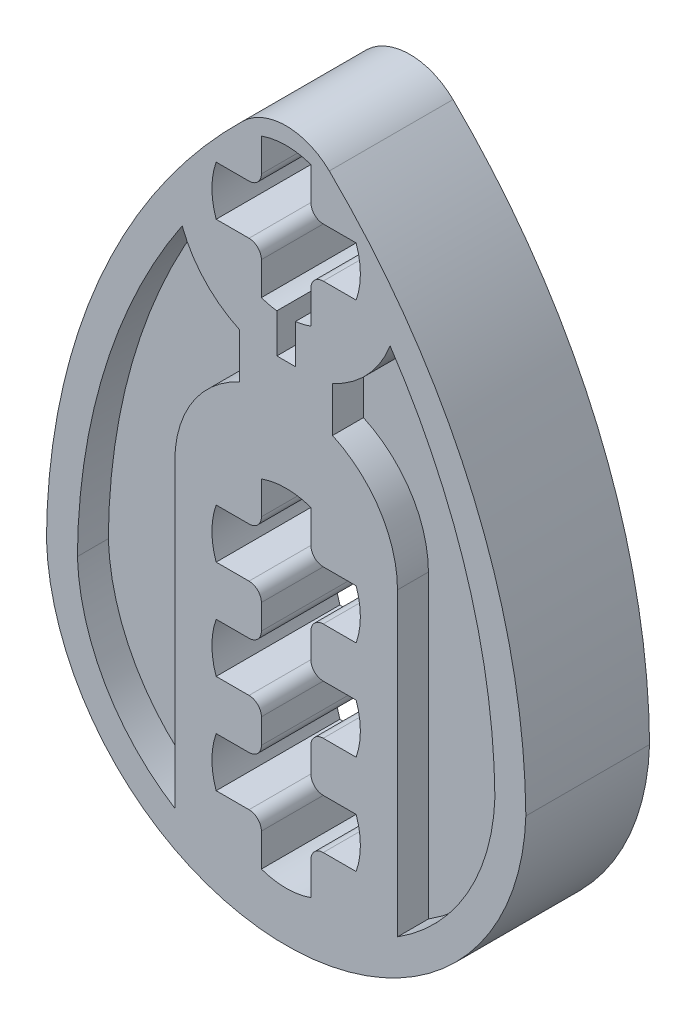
SolidWorks part; units mm, degrees
ref_plane "정면" through (0, 0, 0) normal (0, 0, 1) x (1, 0, 0)
ref_plane "윗면" through (0, 0, 0) normal (0, 1, 0) x (1, 0, 0)
ref_plane "우측면" through (0, 0, 0) normal (1, 0, 0) x (0, 0, -1)
ref_plane "평면1" through (0, 0, -4) normal (0, 0, -1) x (-1, 0, 0)
sketch "스케치1" plane through (0, 0, -4) normal (0, 0, -1) x (-1, 0, 0)
  arc A0 (-228.1591, 460.1494) -> (-212.6591, 460.1494) centre (-220.4091, 460.4045) ccw
  arc A1 (-212.6591, 460.1494) -> (-220.4091, 476.2749) centre (-233.6801, 459.9717) ccw
  arc A2 (-220.4091, 476.2749) -> (-228.1591, 460.1494) centre (-207.138, 459.9717) ccw
extrude "보스-돌출1" add sketch "스케치1" against normal blind 4
sketch "스케치2" plane through (0, 0, -4) normal (0, 0, -1) x (-1, 0, 0)
  line L0 (-221.2091, 459.0503) -> (-221.2091, 457.4503)
  line L1 (-221.2091, 457.4503) -> (-222.6718, 457.4503)
  line L3 (-222.6718, 455.8503) -> (-221.2091, 455.8503)
  line L4 (-221.2091, 455.8503) -> (-221.2091, 454.3876)
  line L6 (-219.6091, 454.3876) -> (-219.6091, 455.8503)
  line L7 (-219.6091, 455.8503) -> (-218.1463, 455.8503)
  line L9 (-218.1463, 457.4503) -> (-219.6091, 457.4503)
  line L10 (-219.6091, 457.4503) -> (-219.6091, 459.0503)
  line L11 (-219.6091, 459.0503) -> (-218.1463, 459.0503)
  line L13 (-218.1463, 460.6503) -> (-219.6091, 460.6503)
  line L14 (-219.6091, 460.6503) -> (-219.6091, 462.2503)
  line L15 (-219.6091, 462.2503) -> (-218.1463, 462.2503)
  line L17 (-218.1463, 463.8503) -> (-219.6091, 463.8503)
  line L18 (-219.6091, 463.8503) -> (-219.6091, 465.313)
  line L20 (-221.2091, 465.313) -> (-221.2091, 463.8503)
  line L21 (-221.2091, 463.8503) -> (-222.6718, 463.8503)
  line L23 (-222.6718, 462.2503) -> (-221.2091, 462.2503)
  line L24 (-221.2091, 462.2503) -> (-221.2091, 460.6503)
  line L25 (-221.2091, 460.6503) -> (-222.6718, 460.6503)
  line L27 (-222.6718, 459.0503) -> (-221.2091, 459.0503)
  line L28 (-220.4091, 452.6503) -> (-220.4091, 469.5765) construction
  line L29 (-222.8091, 459.8503) -> (-214.8891, 459.8503) construction
  arc A0 (-228.1591, 460.1494) -> (-212.6591, 460.1494) centre (-220.4091, 460.4045) ccw construction
  arc A1 (-218.1463, 455.8503) -> (-218.1463, 457.4503) centre (-220.4091, 456.6503) ccw
  arc A2 (-221.2091, 454.3876) -> (-219.6091, 454.3876) centre (-220.4091, 456.6503) ccw
  arc A3 (-222.6718, 457.4503) -> (-222.6718, 455.8503) centre (-220.4091, 456.6503) ccw
  arc A4 (-218.1463, 462.2503) -> (-218.1463, 463.8503) centre (-220.4091, 463.0503) ccw
  arc A5 (-222.6718, 460.6503) -> (-222.6718, 459.0503) centre (-220.4091, 459.8503) ccw
  arc A6 (-218.1463, 459.0503) -> (-218.1463, 460.6503) centre (-220.4091, 459.8503) ccw
  arc A7 (-219.6091, 465.313) -> (-221.2091, 465.313) centre (-220.4091, 463.0503) ccw
  arc A8 (-222.6718, 463.8503) -> (-222.6718, 462.2503) centre (-220.4091, 463.0503) ccw
extrude "컷-돌출1" cut sketch "스케치2" against normal through all
sketch "스케치3" plane through (0, 0, 0) normal (0, 0, 1) x (1, 0, 0)
  line L1 (221.2091, 470.3876) -> (221.2091, 471.8503)
  line L2 (221.2091, 471.8503) -> (222.6718, 471.8503)
  line L4 (222.6718, 473.4503) -> (221.2091, 473.4503)
  line L5 (221.2091, 473.4503) -> (221.2091, 474.913)
  line L7 (219.6091, 474.913) -> (219.6091, 473.4503)
  line L8 (219.6091, 473.4503) -> (218.1463, 473.4503)
  line L10 (218.1463, 471.8503) -> (219.6091, 471.8503)
  line L11 (219.6091, 471.8503) -> (219.6091, 470.3876)
  line L13 (220.1091, 470.2691) -> (220.1091, 469.0045)
  line L14 (220.1091, 469.0045) -> (220.7091, 469.0045)
  line L15 (220.7091, 469.0045) -> (220.7091, 470.2691)
  line L16 (220.4091, 452.6503) -> (220.4091, 477.4706) construction
  line L17 (218.0091, 472.6503) -> (225.1749, 472.6503) construction
  arc A0 (212.6591, 460.1494) -> (228.1591, 460.1494) centre (220.4091, 460.4045) ccw construction
  arc A1 (222.6718, 471.8503) -> (222.6718, 473.4503) centre (220.4091, 472.6503) ccw
  arc A2 (219.6091, 470.3876) -> (220.1091, 470.2691) centre (220.4091, 472.6503) ccw
  arc A3 (221.2091, 474.913) -> (219.6091, 474.913) centre (220.4091, 472.6503) ccw
  arc A4 (218.1463, 473.4503) -> (218.1463, 471.8503) centre (220.4091, 472.6503) ccw
  arc A5 (219.6091, 454.3876) -> (221.2091, 454.3876) centre (220.4091, 456.6503) ccw construction
  arc A6 (220.7091, 470.2691) -> (221.2091, 470.3876) centre (220.4091, 472.6503) ccw
  dimension "D5" = 16
  dimension "D1" = 1.6
  dimension "D2" = 1.6
  dimension "D4" = 0.6
extrude "컷-돌출2" cut sketch "스케치3" against normal through all
sketch "스케치4" plane through (0, 0, -4) normal (0, 0, -1) x (-1, 0, 0)
  line L0 (-221.9091, 467.6771) -> (-221.9091, 469.1319)
  line L1 (-224.0091, 454.6897) -> (-224.0091, 464.4045)
  arc A0 (-221.9091, 469.1319) -> (-223.771, 471.117) centre (-220.4091, 472.4045) cw
  arc A1 (-223.771, 471.117) -> (-227.1589, 460.1621) centre (-207.138, 459.9717) ccw
  arc A2 (-227.1589, 460.1621) -> (-224.0091, 454.6897) centre (-220.4091, 460.4045) ccw
  arc A3 (-224.0091, 464.4045) -> (-221.9091, 467.6771) centre (-220.4091, 464.4045) cw
extrude "컷-돌출3" cut sketch "스케치4" against normal blind 1
sketch "스케치5" plane through (0, 0, -4) normal (0, 0, -1) x (-1, 0, 0)
  line L0 (-216.8091, 464.4045) -> (-216.8091, 454.6897)
  line L1 (-218.9091, 469.1319) -> (-218.9091, 467.6771)
  arc A0 (-218.9091, 467.6771) -> (-216.8091, 464.4045) centre (-220.4091, 464.4045) cw
  arc A1 (-216.8091, 454.6897) -> (-213.6592, 460.1621) centre (-220.4091, 460.4045) ccw
  arc A2 (-213.6592, 460.1621) -> (-217.0472, 471.117) centre (-233.6801, 459.9717) ccw
  arc A3 (-217.0472, 471.117) -> (-218.9091, 469.1319) centre (-220.4091, 472.4045) cw
extrude "컷-돌출4" cut sketch "스케치5" against normal blind 1
sketch "스케치6" plane through (0, 0, 0) normal (0, 0, 1) x (1, 0, 0)
  line L0 (218.9091, 467.6771) -> (218.9091, 469.1319)
  line L1 (216.8091, 454.6897) -> (216.8091, 464.4045)
  arc A0 (216.8091, 464.4045) -> (218.9091, 467.6771) centre (220.4091, 464.4045) cw
  arc A1 (218.9091, 469.1319) -> (217.0472, 471.117) centre (220.4091, 472.4045) cw
  arc A2 (217.0472, 471.117) -> (213.6592, 460.1621) centre (233.6801, 459.9717) ccw
  arc A3 (213.6592, 460.1621) -> (216.8091, 454.6897) centre (220.4091, 460.4045) ccw
extrude "컷-돌출5" cut sketch "스케치6" against normal blind 1
sketch "스케치7" plane through (0, 0, 0) normal (0, 0, 1) x (1, 0, 0)
  line L0 (221.9091, 469.1319) -> (221.9091, 467.6771)
  line L1 (224.0091, 464.4045) -> (224.0091, 454.6897)
  arc A0 (221.9091, 467.6771) -> (224.0091, 464.4045) centre (220.4091, 464.4045) cw
  arc A1 (224.0091, 454.6897) -> (227.1589, 460.1621) centre (220.4091, 460.4045) ccw
  arc A2 (227.1589, 460.1621) -> (223.771, 471.117) centre (207.138, 459.9717) ccw
  arc A3 (223.771, 471.117) -> (221.9091, 469.1319) centre (220.4091, 472.4045) cw
extrude "컷-돌출6" cut sketch "스케치7" against normal blind 1
fillet "필렛1" radius 2 1 edges at (220.4091, 476.2749, -2)
fillet "필렛2" radius 0.4 16 edges at (221.2091, 473.4503, -2) (219.6091, 473.4503, -2) (219.6091, 471.8503, -2) (221.2091, 471.8503, -2) (219.6091, 459.0503, -2) (221.2091, 459.0503, -2) (219.6091, 462.2503, -2) (221.2091, 462.2503, -2) (219.6091, 455.8503, -2) (221.2091, 455.8503, -2) (219.6091, 463.8503, -2) (221.2091, 463.8503, -2) (219.6091, 460.6503, -2) (221.2091, 460.6503, -2) (221.2091, 457.4503, -2) (219.6091, 457.4503, -2)
